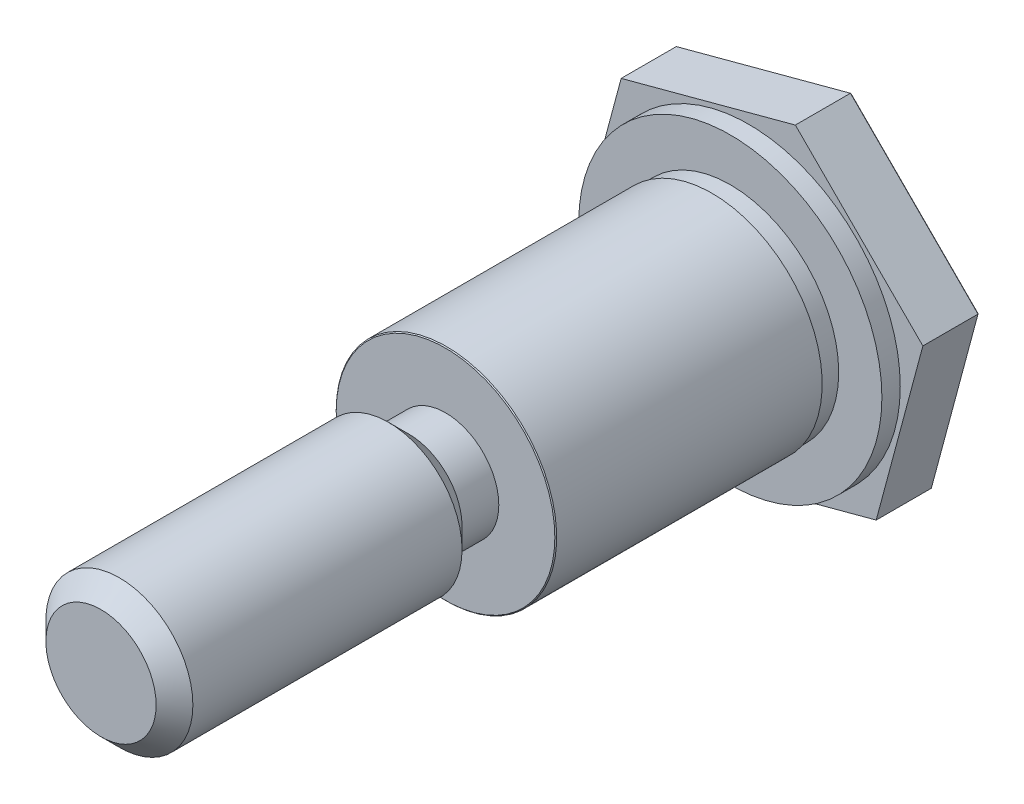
SolidWorks part; units mm, degrees
ref_plane "Plan1" through (0, 0, 0) normal (0, 0, 1) x (1, 0, 0)
ref_plane "Plan2" through (0, 0, 0) normal (0, 1, 0) x (1, 0, 0)
ref_plane "Plan3" through (0, 0, 0) normal (1, 0, 0) x (0, 0, -1)
sketch "Esquisse2" plane through (0, 0, 0) normal (0, 0, 1) x (1, 0, 0)
  line L1 (6.9402, -6.9402) -> (9.4805, 2.5403)
  line L2 (9.4805, 2.5403) -> (2.5403, 9.4805)
  line L3 (2.5403, 9.4805) -> (-6.9402, 6.9402)
  line L4 (-6.9402, 6.9402) -> (-9.4805, -2.5403)
  line L5 (-9.4805, -2.5403) -> (-2.5403, -9.4805)
  line L6 (-2.5403, -9.4805) -> (6.9402, -6.9402)
  circle A0 centre (0, 0) radius 8.5 construction
  dimension "D1" = 17
extrude "Base-Extrusion" add sketch "Esquisse2" along normal blind 3.05
sketch "Esquisse3" plane through (0, 0, 3.05) normal (0, 0, 1) x (1, 0, 0)
  circle A0 centre (0, 0) radius 8.25
  dimension "D1" = 16.5
extrude "Boss.-Extru.1" add sketch "Esquisse3" along normal blind 1
sketch "Esquisse4" plane through (0, 0, 4.05) normal (0, 0, 1) x (1, 0, 0)
  circle A0 centre (0, 0) radius 5.9
  dimension "D1" = 11.8
extrude "Boss.-Extru.2" add sketch "Esquisse4" along normal blind 1
sketch "Esquisse5" plane through (0, 0, 5.05) normal (0, 0, 1) x (1, 0, 0)
  circle A0 centre (0, 0) radius 6
  dimension "D1" = 12
extrude "Boss.-Extru.3" add sketch "Esquisse5" along normal blind 14.5
sketch "Esquisse6" plane through (0, 0, 19.55) normal (0, 0, 1) x (1, 0, 0)
  circle A0 centre (0, 0) radius 2.9
  dimension "D1" = 5.8
extrude "Boss.-Extru.5" add sketch "Esquisse6" along normal blind 2
sketch "Esquisse8" plane through (0, 0, 21.55) normal (0, 0, 1) x (1, 0, 0)
  circle A0 centre (0, 0) radius 4
  dimension "D1" = 8
extrude "Boss.-Extru.6" add sketch "Esquisse8" along normal blind 16.75
chamfer "Chanfrein2" distance 1.1 angle 45 1 edges at (4, 0, 21.55)
chamfer "Chanfrein3" distance 1 angle 45 1 edges at (4, 0, 38.3)
chamfer "Chanfrein4" distance 0.05 angle 45 1 edges at (6, 0, 19.55)
chamfer "Chanfrein5" distance 0.05 angle 45 6 edges at (-6.0104, -6.0104, 0) (-8.2104, 2.2, 0) (-2.2, 8.2104, 0) (6.0104, 6.0104, 0) (8.2104, -2.2, 0) (2.2, -8.2104, 0)
